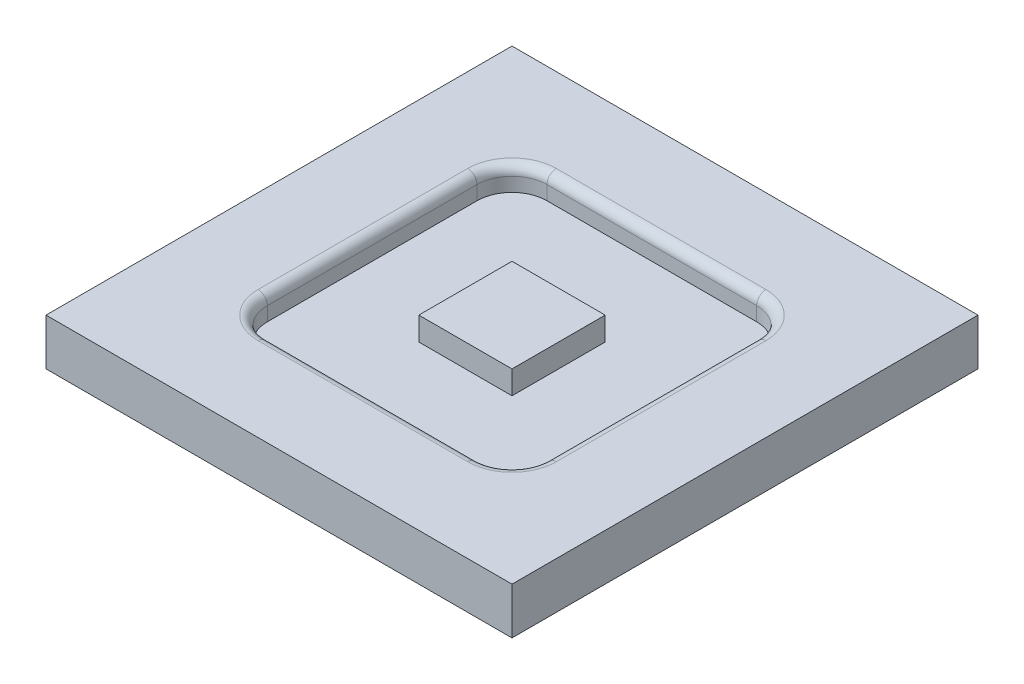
SolidWorks part; units mm, degrees
ref_plane "Front Plane" through (0, 0, 0) normal (0, 0, 1) x (1, 0, 0)
ref_plane "Top Plane" through (0, 0, 0) normal (0, 1, 0) x (1, 0, 0)
ref_plane "Right Plane" through (0, 0, 0) normal (1, 0, 0) x (0, 0, -1)
sketch "Sketch1" plane through (0, 0, 0) normal (0, 1, 0) x (1, 0, 0)
  line L0 (-63.5, -63.5) -> (63.5, 63.5) construction
  line L1 (-63.5, 63.5) -> (63.5, 63.5)
  line L2 (-63.5, 63.5) -> (-63.5, -63.5)
  line L3 (-63.5, -63.5) -> (63.5, -63.5)
  line L4 (63.5, 63.5) -> (63.5, -63.5)
  dimension "D1" = 127
extrude "Extrude1" add sketch "Sketch1" along normal blind 12.7
sketch "Sketch2" plane through (0, 12.7, 0) normal (0, 1, 0) x (-1, 0, 0)
  line L0 (38.1, -38.1) -> (-38.1, 38.1) construction
  line L1 (-38.1, -38.1) -> (38.1, -38.1)
  line L2 (-38.1, -38.1) -> (-38.1, 38.1)
  line L3 (-38.1, 38.1) -> (38.1, 38.1)
  line L4 (38.1, -38.1) -> (38.1, 38.1)
  dimension "D1" = 76.2
extrude "Cut-Extrude1" cut sketch "Sketch2" against normal blind 6.35
fillet "Fillet1" radius 9.525 4 edges at (38.1, 9.525, -38.1) (38.1, 9.525, 38.1) (-38.1, 9.525, 38.1) (-38.1, 9.525, -38.1)
sketch "Sketch3" plane through (0, 6.35, 0) normal (0, 1, 0) x (-1, 0, 0)
  line L0 (12.7, -12.7) -> (-12.7, 12.7) construction
  line L1 (-12.7, -12.7) -> (12.7, -12.7)
  line L2 (-12.7, -12.7) -> (-12.7, 12.7)
  line L3 (-12.7, 12.7) -> (12.7, 12.7)
  line L4 (12.7, -12.7) -> (12.7, 12.7)
  dimension "D1" = 25.4
  dimension "D2" = 25.4
extrude "Extrude2" add sketch "Sketch3" along normal up to surface (6.35 mm away)
fillet "Fillet2" radius 2.54 8 edges at (-38.1, 12.7, 0) (0, 12.7, -38.1) (0, 12.7, 38.1) (38.1, 12.7, 0) (-35.3102, 12.7, -35.3102) (-35.3102, 12.7, 35.3102) (35.3102, 12.7, 35.3102) (35.3102, 12.7, -35.3102)
